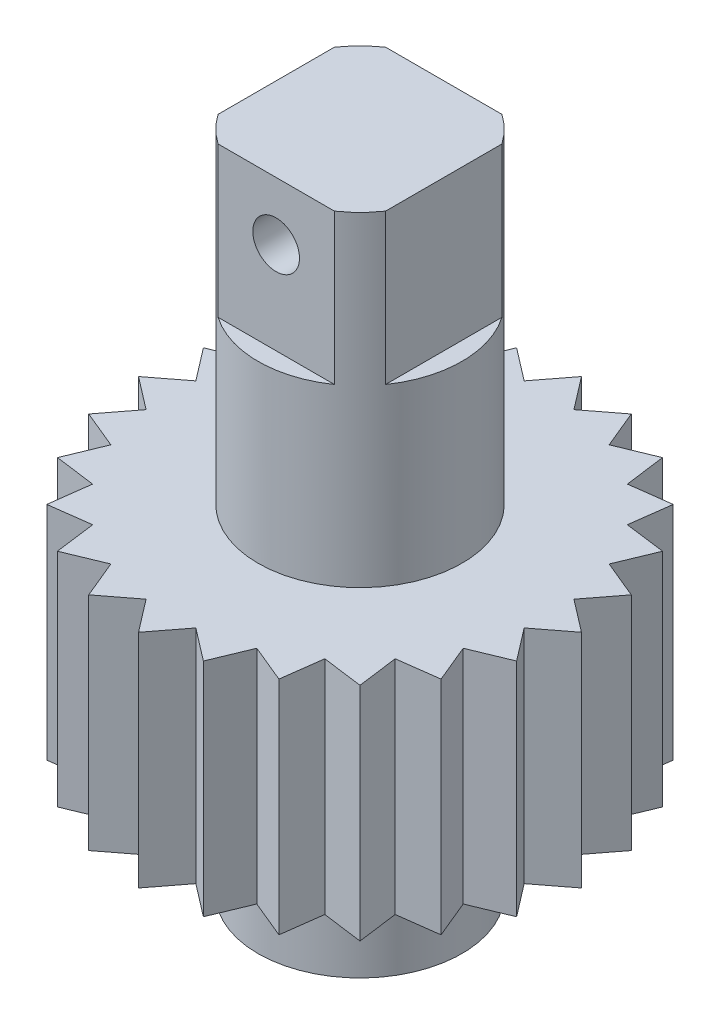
SolidWorks part; units mm, degrees
ref_plane "FRONT" through (0, 0, 0) normal (0, 0, 1) x (1, 0, 0)
ref_plane "TOP" through (0, 0, 0) normal (0, 1, 0) x (1, 0, 0)
ref_plane "RIGHT" through (0, 0, 0) normal (1, 0, 0) x (0, 0, -1)
sketch "Sketch5" plane through (0, 0, 0) normal (0, 1, 0) x (1, 0, 0)
  circle A0 centre (0, 0) radius 12.065
  dimension "D1" = 24.13
extrude "Base-Extrude" add sketch "Sketch5" along normal blind 12.065
sketch "Sketch6" plane through (0, 12.065, 0) normal (0, 1, 0) x (-1, 0, 0)
  line L0 (0, 0) -> (-21.413, 0) construction
  line L1 (0, 0) -> (-20.7465, -5.559) construction
  line L2 (0, 0) -> (-17.3874, -2.2891) construction
  line L3 (-11.6539, -3.1227) -> (-10.2981, -1.3558)
  line L4 (-10.2981, -1.3558) -> (-12.065, 0)
  circle A0 centre (0, 0) radius 12.065 construction
  arc A1 (-12.065, 0) -> (-11.6539, -3.1227) centre (0, 0) ccw
  dimension "D1" = 15
  dimension "D2" = 7.5
extrude "Cut-Extrude1" cut sketch "Sketch6" against normal through all
pattern_circular "CirPattern1" count 24 every 15 about axis through (0, 0, 0) along (0, 1, 0) of "Cut-Extrude1"
sketch "Sketch7" plane through (0, 12.065, 0) normal (0, 1, 0) x (-1, 0, 0)
  circle A0 centre (0, 0) radius 5.5562
  dimension "D1" = 11.1125
extrude "Boss-Extrude1" add sketch "Sketch7" along normal blind 9.525
sketch "Sketch8" plane through (0, 21.59, 0) normal (0, 1, 0) x (-1, 0, 0)
  line L0 (3.1688, 4.5641) -> (-3.1688, 4.5641)
  line L1 (4.5641, 3.1688) -> (4.5641, -3.1688)
  line L2 (-3.1688, -4.5641) -> (3.1688, -4.5641)
  line L3 (-4.5641, -3.1688) -> (-4.5641, 3.1688)
  circle A0 centre (0, 0) radius 5.5562 construction
  arc A1 (3.1688, -4.5641) -> (4.5641, -3.1688) centre (0, 0) ccw
  arc A2 (-4.5641, -3.1688) -> (-3.1688, -4.5641) centre (0, 0) ccw
  arc A3 (-3.1688, 4.5641) -> (-4.5641, 3.1688) centre (0, 0) ccw
  arc A4 (4.5641, 3.1688) -> (3.1688, 4.5641) centre (0, 0) ccw
  dimension "D1" = 9.1281
  dimension "D2" = 9.1281
  dimension "D3" = 4.5641
  dimension "D4" = 4.5641
extrude "Boss-Extrude2" add sketch "Sketch8" along normal blind 8.1788
sketch "Sketch9" plane through (0, 0, 0) normal (0, -1, 0) x (1, 0, 0)
  circle A0 centre (0, 0) radius 5.5562
  circle A1 centre (0, 0) radius 5.5562 construction
extrude "Boss-Extrude3" add sketch "Sketch9" along normal blind 6.35
sketch "Sketch10" plane through (0, 0, 4.5641) normal (0, 0, 1) x (1, 0, 0)
  line L0 (-3.1688, 29.7688) -> (3.1688, 29.7688) construction
  line L1 (-4.5641, 29.7688) -> (-4.5641, 21.59) construction
  circle A0 centre (-0.0048, 26.5938) radius 1.27
  dimension "D1" = 2.54
  dimension "D2" = 3.175
  dimension "D3" = 4.5593
extrude "Cut-Extrude2" cut sketch "Sketch10" against normal blind 6.35
equation "\"D2@Sketch6\" = \"D1@Sketch6\"/2"
